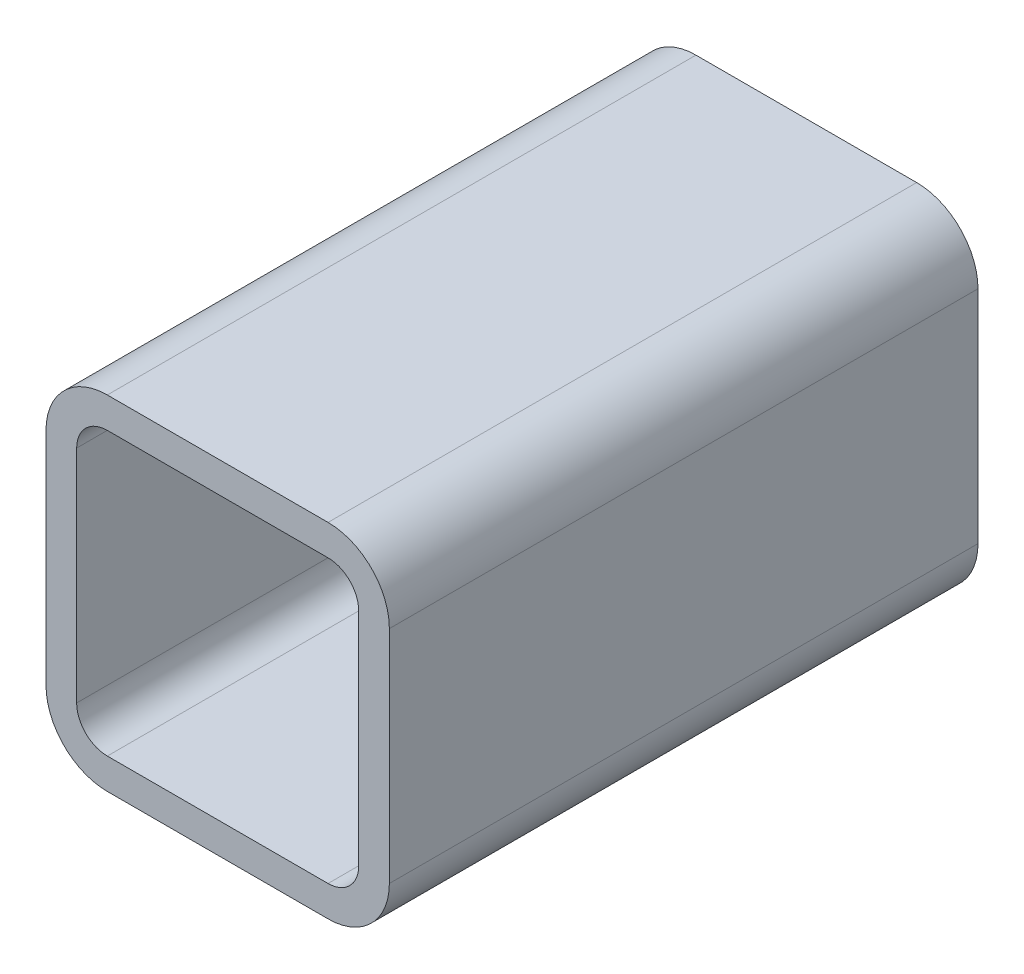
SolidWorks part; units mm, degrees
ref_plane "Front Plane" through (0, 0, 0) normal (0, 0, 1) x (1, 0, 0)
ref_plane "Top Plane" through (0, 0, 0) normal (0, 1, 0) x (1, 0, 0)
ref_plane "Right Plane" through (0, 0, 0) normal (1, 0, 0) x (0, 0, -1)
sketch "Sketch1" plane through (0, 0, 0) normal (0, 0, 1) x (1, 0, 0)
sketch_block_instance "HSS7x7x0.625-1"
sketch_block "HSS7x7x0.625"
extrude "Boss-Extrude1" add sketch "Sketch1" along normal blind 304.8
